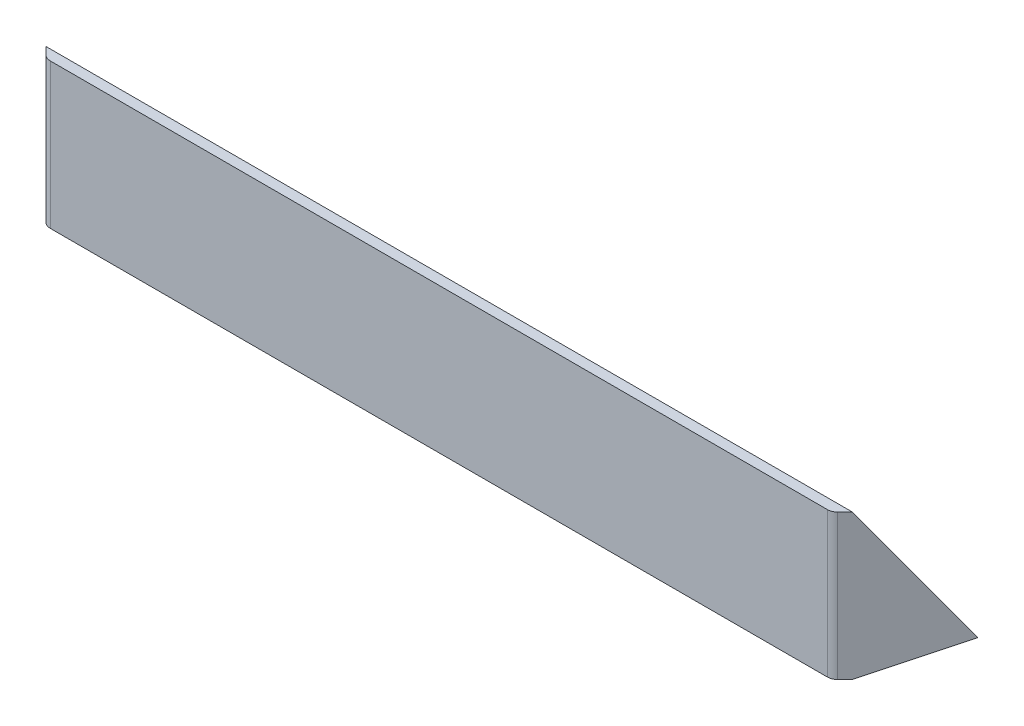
SolidWorks part; units mm, degrees
ref_plane "Face" through (0, 0, 0) normal (0, 0, 1) x (1, 0, 0)
ref_plane "Dessus" through (0, 0, 0) normal (0, 1, 0) x (1, 0, 0)
ref_plane "Droite" through (0, 0, 0) normal (1, 0, 0) x (0, 0, -1)
sketch "Esquisse1" plane through (0, 0, 0) normal (0, 1, 0) x (1, 0, 0)
  line L0 (-379.1421, 0) -> (379.1421, 0)
  line L1 (379.1421, 0) -> (455, 75.8579)
  line L2 (455, 75.8579) -> (447.9289, 82.9289)
  line L3 (447.9289, 82.9289) -> (375, 10)
  line L4 (375, 10) -> (-375, 10)
  line L5 (0, 0) -> (0, 162.0938) construction
  line L6 (-447.9289, 82.9289) -> (-375, 10)
  line L7 (-455, 75.8579) -> (-447.9289, 82.9289)
  line L8 (-379.1421, 0) -> (-455, 75.8579)
  point P9 (0, 10)
  dimension "D1" = 10
  dimension "D2" = 10
  dimension "D3" = 45
  dimension "D4" = 455
  dimension "D5" = 80
extrude "Extrusion1" add sketch "Esquisse1" along normal blind 140
fillet "Congé2" radius 10 2 edges at (-379.1421, 70, 0) (379.1421, 70, 0)
sketch "Esquisse5" plane through (0, 0, 0) normal (1, 0, 0) x (0, 0, -1)
  line L0 (10, 0) -> (70.6218, 35)
  line L1 (70.6218, 35) -> (0.4405, 156.5575)
  line L2 (0.4405, 156.5575) -> (68.5162, 195.861)
  line L3 (68.5162, 195.861) -> (175.2585, 84.2039)
  line L4 (175.2585, 84.2039) -> (175.2585, -80.0107)
  line L5 (175.2585, -80.0107) -> (10, -74.6712)
  line L6 (10, -74.6712) -> (10, 0)
  line L7 (75.8579, 0) -> (2.9289, 0) construction
  dimension "D1" = 30
extrude "Enlèv. mat.-Extru.4" cut sketch "Esquisse5" against normal through all and the other way through all
